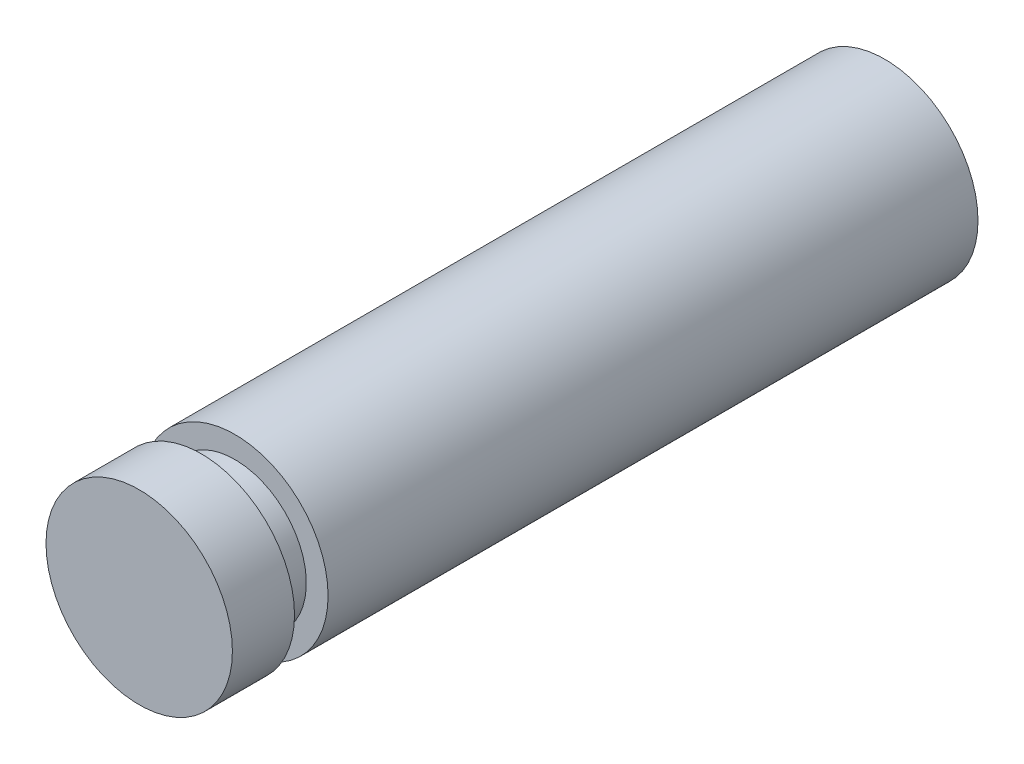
SolidWorks part; units mm, degrees
ref_plane "Front" through (0, 0, 0) normal (0, 0, 1) x (1, 0, 0)
ref_plane "Top" through (0, 0, 0) normal (0, 1, 0) x (1, 0, 0)
ref_plane "Right" through (0, 0, 0) normal (1, 0, 0) x (0, 0, -1)
sketch "Esquisse1" plane through (0, 0, 0) normal (0, 0, 1) x (1, 0, 0)
  circle A0 centre (0, 0) radius 1.5
  dimension "D1" = 3
extrude "Boss.-Extru.1" add sketch "Esquisse1" along normal blind 12 contours A0
sketch "Esquisse2" plane through (0, 0, 0) normal (0, 1, 0) x (1, 0, 0)
  line L0 (0, 1.0072) -> (0, -11.6772) construction
  line L1 (1.15, -10.46) -> (2.1014, -10.46)
  line L2 (1.15, -10.46) -> (1.15, -11)
  line L3 (1.15, -11) -> (2.1014, -11)
  line L4 (2.1014, -10.46) -> (2.1014, -11)
  line L5 (-1.5, -12) -> (1.5, -12) construction
  dimension "D1" = 0.54
  dimension "D2" = 1
  dimension "D3" = 2.3
revolve "Enlèvement de matière-Révolution1" cut sketch "Esquisse2" angle 360 about L0
